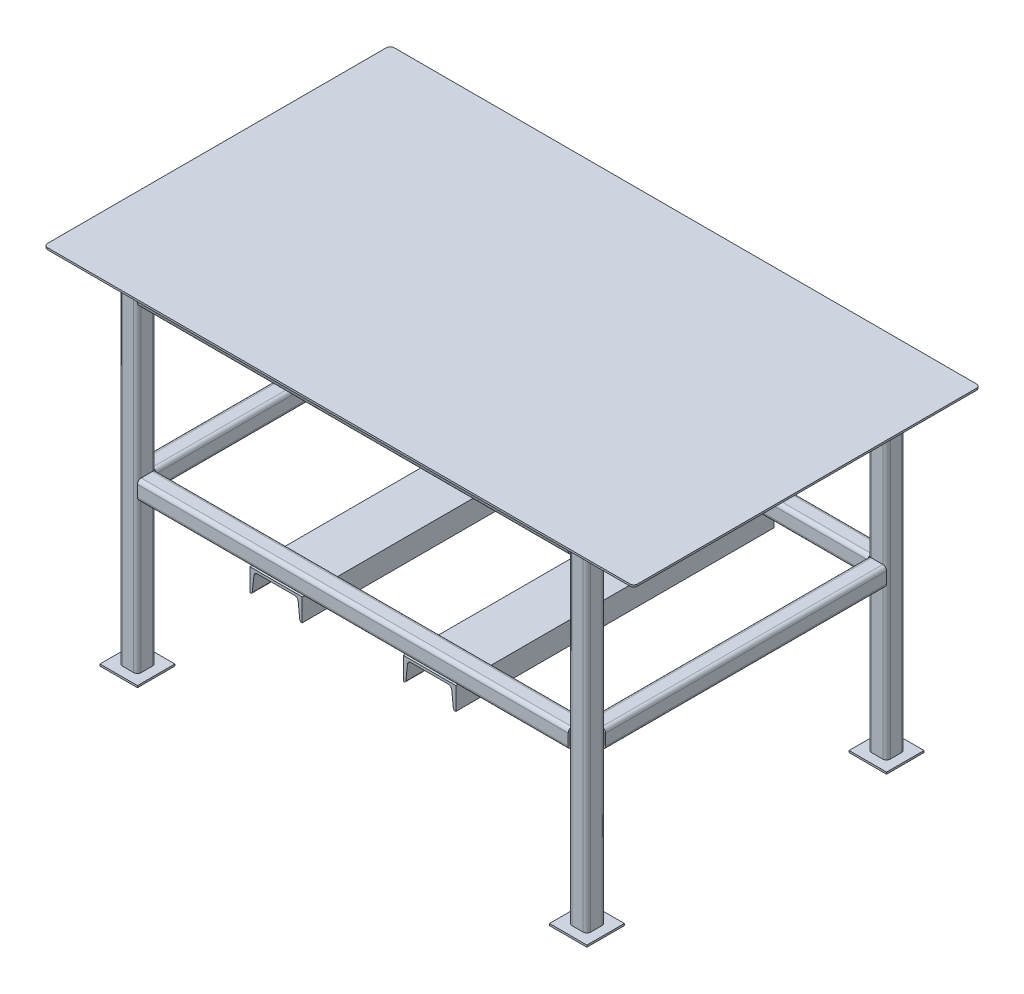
SolidWorks part; units mm, degrees
ref_plane "Front Plane" through (0, 0, 0) normal (0, 0, 1) x (1, 0, 0)
ref_plane "Top Plane" through (0, 0, 0) normal (0, 1, 0) x (1, 0, 0)
ref_plane "Right Plane" through (0, 0, 0) normal (1, 0, 0) x (0, 0, -1)
sketch3d "Frame Layout"
  line L0 (-600, 0, 400) -> (-600, 900, 400)
  line L1 (-600, 0, 400) -> (-600, 0, -400) construction
  line L2 (-600, 0, 400) -> (600, 0, 400) construction
  line L3 (600, 0, 400) -> (600, 0, -400) construction
  line L4 (-600, 0, -400) -> (600, 0, -400) construction
  line L5 (-600, 0, 400) -> (600, 0, -400) construction
  line L6 (600, 0, 400) -> (-600, 0, -400) construction
  line L7 (-600, 0, -400) -> (-600, 900, -400)
  line L8 (600, 0, 400) -> (600, 900, 400)
  line L9 (600, 0, -400) -> (600, 900, -400)
  line L10 (0, 900, -400) -> (0, 900, 400)
  line L11 (-600, 900, 400) -> (-600, 900, -400)
  line L12 (-600, 900, 400) -> (600, 900, 400)
  line L13 (600, 900, 400) -> (600, 900, -400)
  line L14 (-600, 900, -400) -> (600, 900, -400)
  line L15 (-600, 450, 400) -> (-600, 450, -400)
  line L16 (-600, 450, -400) -> (600, 450, -400)
  line L17 (600, 450, -400) -> (600, 450, 400)
  line L18 (600, 450, 400) -> (-600, 450, 400)
  point P0 (0, 0, 0)
  dimension "D1" = 1200
  dimension "D2" = 800
  dimension "D3" = 900
other "Tube (square) 50 X 50 X 5.0(1)"
ref_plane "Plane1" through (-600, 0, 400) normal (0, 1, 0) x (1, 0, 0)
sketch "Sketch1" plane through (-600, 0, 400) normal (0, 1, 0) x (1, 0, 0)
  line L0 (-15, -20) -> (15, -20)
  line L1 (-20, -15) -> (-20, 15)
  line L2 (15, 20) -> (-15, 20)
  line L3 (20, 15) -> (20, -15)
  line L4 (-15, -25) -> (15, -25)
  line L5 (-25, -15) -> (-25, 15)
  line L6 (15, 25) -> (-15, 25)
  line L7 (25, 15) -> (25, -15)
  line L8 (-25, 0) -> (-20, 0) construction
  line L9 (-20, 0) -> (20, 0) construction
  line L10 (20, 0) -> (25, 0) construction
  line L12 (0, 25) -> (0, 20) construction
  line L13 (0, 20) -> (0, -20) construction
  line L14 (0, -20) -> (0, -25) construction
  arc A0 (25, 15) -> (15, 25) centre (15, 15) ccw
  arc A1 (15, -25) -> (25, -15) centre (15, -15) ccw
  arc A2 (-25, -15) -> (-15, -25) centre (-15, -15) ccw
  arc A3 (-15, 25) -> (-25, 15) centre (-15, 15) ccw
  arc A4 (-15, 20) -> (-20, 15) centre (-15, 15) ccw
  arc A5 (20, 15) -> (15, 20) centre (15, 15) ccw
  arc A6 (15, -20) -> (20, -15) centre (15, -15) ccw
  arc A7 (-20, -15) -> (-15, -20) centre (-15, -15) ccw
  point P2 (-25, 25)
  point P33 (-25, -25)
  point P34 (25, -25)
  point P36 (25, 25)
  point P37 (0, 0)
  dimension "D1" = 10
  dimension "Thickness" = 5
  dimension "V_leg" = 50
  dimension "H_leg" = 50
sketch "Sketch2" plane through (0, 900, 0) normal (0, 1, 0) x (1, 0, 0)
  line L1 (787.5, 462.5) -> (-787.5, 462.5)
  line L2 (787.5, 462.5) -> (787.5, -462.5)
  line L3 (787.5, -462.5) -> (-787.5, -462.5)
  line L4 (-787.5, 462.5) -> (-787.5, -462.5)
  line L5 (787.5, 462.5) -> (-787.5, -462.5) construction
  line L6 (787.5, -462.5) -> (-787.5, 462.5) construction
  point P0 (0, 0)
  dimension "D1" = 1575
  dimension "D2" = 925
extrude "Top Plate" add sketch "Sketch2" along normal blind 5 separate body
sketch "Sketch3" plane through (0, 0, 0) normal (0, -1, 0) x (1, 0, 0)
  line L0 (-615, 425) -> (-585, 425) construction
  line L1 (-650, 450) -> (-550, 450)
  line L2 (-650, 450) -> (-650, 350)
  line L3 (-650, 350) -> (-550, 350)
  line L4 (-550, 450) -> (-550, 350)
  line L5 (-600, 350) -> (-600, 450) construction
  line L6 (-650, 400) -> (-550, 400) construction
  line L7 (-575, 415) -> (-575, 385) construction
  point P0 (-600, 400)
  point P6 (-600, 425)
  point P9 (-575, 400)
  dimension "D1" = 100
extrude "Base Plate" add sketch "Sketch3" along normal blind 5 separate body
mirror "Mirror1" about plane through (0, 0, 0) normal (0, 0, 1)
mirror "Mirror2" about plane through (0, 0, 0) normal (1, 0, 0)
fillet "Fillet1" radius 10 4 edges at (-787.5, 902.5, -462.5) (787.5, 902.5, -462.5) (787.5, 902.5, 462.5) (-787.5, 902.5, 462.5)
sketch "Channel Layout" plane through (0, 400, 0) normal (0, -1, 0) x (1, 0, 0)
  line L0 (0, -425) -> (0, 425) construction
  line L1 (575, 425) -> (-575, 425) construction
  line L2 (-205, 425) -> (-205, -425)
  line L3 (575, -425) -> (-575, -425) construction
  line L4 (205, 425) -> (205, -425)
  point P4 (0, 0)
  dimension "D1" = 410
other "C channel CH 140 X 15(1)"
ref_plane "Plane2" through (-135, 400, 425) normal (0, 0, -1) x (0, -1, 0)
sketch "Sketch11" plane through (-135, 400, 425) normal (0, 0, -1) x (0, -1, 0)
  line L0 (60, 140) -> (0, 140)
  line L1 (60, 0) -> (0, 0)
  line L2 (0, 140) -> (0, 0)
  line L5 (0, 9) -> (30.8145, 9) construction
  line L6 (60, 140) -> (60, 137.8528)
  line L7 (60, 0) -> (60, 2.1472)
  line L12 (6.7, 120.0953) -> (6.7, 19.9047)
  line L17 (14.7592, 129.046) -> (55.9704, 133.3775)
  line L18 (14.7592, 10.954) -> (55.9704, 6.6225)
  arc A0 (55.9704, 133.3775) -> (60, 137.8528) centre (55.5, 137.8528) ccw
  arc A1 (55.9704, 6.6225) -> (60, 2.1472) centre (55.5, 2.1472) cw
  arc A9 (6.7, 19.9047) -> (14.7592, 10.954) centre (15.7, 19.9047) ccw
  arc A10 (6.7, 120.0953) -> (14.7592, 129.046) centre (15.7, 120.0953) cw
  point P10 (30, 140)
  point P11 (30, 0)
  point P12 (6.7, 70)
  point P13 (0, 70)
  point P14 (0, 0)
  dimension "RI" = 9
  dimension "D2" = 6
  dimension "RA" = 4.5
  dimension "D3" = 19.9047
  dimension "Depth" = 140
  dimension "BF" = 60
  dimension "TW" = 6.7
  dimension "TF" = 9
  dimension "d1" = 100.1907
